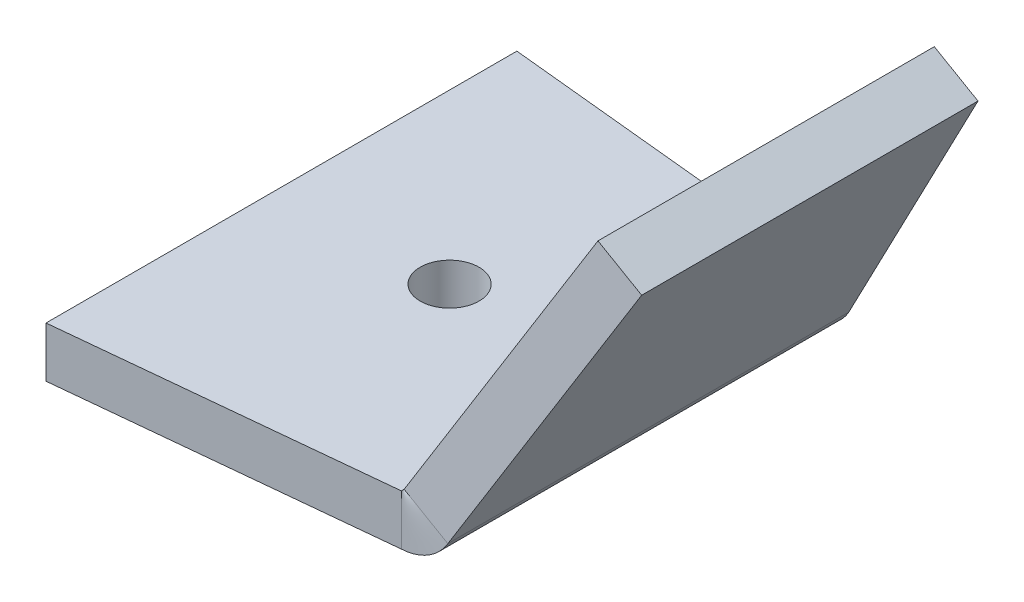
SolidWorks part; units mm, degrees
ref_plane "Front" through (0, 0, 0) normal (0, 0, 1) x (1, 0, 0)
ref_plane "Top" through (0, 0, 0) normal (0, 1, 0) x (1, 0, 0)
ref_plane "Right" through (0, 0, 0) normal (1, 0, 0) x (0, 0, -1)
sketch "Sketch1" plane through (0, 0, 0) normal (0, 1, 0) x (1, 0, 0)
  line L1 (40, -10) -> (40, 10)
  line L2 (40, 10) -> (0, 14)
  line L3 (0, 14) -> (0, -14)
  line L4 (40, -10) -> (0, -14)
  circle A0 centre (10, 0) radius 1.75
sheet metal parameters "Sheet-Metal1" thickness 3 parameters "D1"=0.01
base flange "Base-Flange1" sketch "Sketch1" thickness 3 reverse thickness direction yes parameters "D1"=0.01
sketch "Sketch3" plane through (0, 3, 0) normal (0, 1, 0) x (-1, 0, 0)
  line L0 (-20, -12) -> (-20, 12)
  line L1 (-40, -10) -> (0, -14) construction
  line L2 (0, 14) -> (-40, 10) construction
sketched bend "Sketched Bend1" parameters "D1"=0.01
bend "SketchBend1" bend radius 0.01 bend angle 60 parameters "D5"=1
flat pattern "Flat-Pattern1"
sketch "Bend-Lines1" plane through (0, 3, 0) normal (0, 1, 0) x (-1, 0, 0)
  line L0 (-20, 12) -> (-20, -12) construction
bend of the flat pattern "Flatten-<SketchBend1>1"
